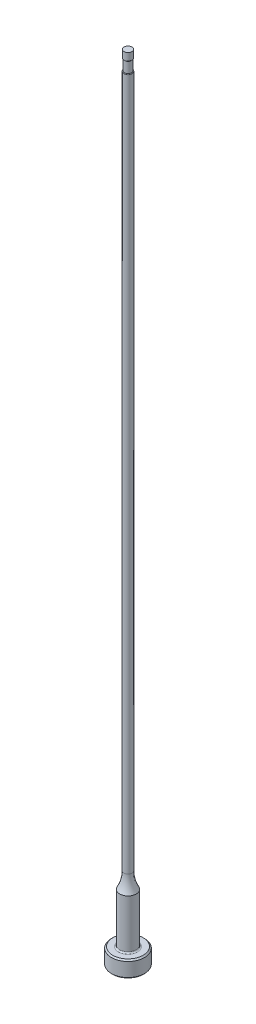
SolidWorks part; units mm, degrees
ref_plane "Front Plane" through (0, 0, 0) normal (0, 0, 1) x (1, 0, 0)
ref_plane "Top Plane" through (0, 0, 0) normal (0, 1, 0) x (1, 0, 0)
ref_plane "Right Plane" through (0, 0, 0) normal (1, 0, 0) x (0, 0, -1)
other "Configuration Table"
sketch "Sketch1" plane through (0, 0, 0) normal (0, 0, 1) x (1, 0, 0)
  line L0 (0, 259.9588) -> (0, -15.1925) construction
  line L1 (0, 0) -> (-3.175, 0)
  line L2 (-3.175, 0) -> (-3.175, 3.175)
  line L3 (-3.175, 3.175) -> (-1.5875, 3.175)
  line L4 (-0.7937, 15.7742) -> (-0.7937, 152.4)
  line L5 (-0.7937, 152.4) -> (0, 152.4)
  line L6 (0, 152.4) -> (0, 0)
  line L7 (-1.5875, 3.175) -> (-1.5875, 12.7)
  arc A1 (-1.5875, 12.7) -> (-0.7937, 15.7742) centre (-7.1437, 15.7742) ccw
  dimension "D1" = 6.35
  dimension "L" = 152.4
  dimension "D2" = 3.175
  dimension "H" = 6.35
  dimension "T" = 3.175
  dimension "D" = 1.5875
  dimension "S" = 12.7
revolve "Revolve1" add sketch "Sketch1" angle 360 about L0
chamfer "Chamfer1" distance 0.254 angle 45 2 edges at (0, 3.175, 3.175) (0, 0, 3.175)
fillet "Fillet1" radius 0.254 1 edges at (0, 3.175, 1.5875)
sketch "Sketch2" plane through (0, 0, 0) normal (0, 0, 1) x (1, 0, 0)
  line L0 (-0.7937, 152.4) -> (-0.7937, 15.7742) construction
  line L1 (-0.7937, 150.876) -> (-0.6921, 150.876)
  line L2 (-0.7937, 150.876) -> (-0.7937, 148.844)
  line L3 (-0.7937, 148.844) -> (-0.6921, 148.844)
  line L4 (-0.6921, 150.876) -> (-0.6921, 148.844)
  line L5 (0.7937, 152.4) -> (-0.7937, 152.4) construction
  line L6 (0, 153.4483) -> (0, 147.3282) construction
  dimension "D1" = 2.032
  dimension "N" = 1.524
  dimension "FD" = 0.1016
  dimension "D3" = 1.3843
revolve "Vent Relief" cut sketch "Sketch2" angle 360 about L6
sketch "Sketch3" plane through (0, 0, 0) normal (0, 0, 1) x (1, 0, 0)
  line L0 (-0.6921, 149.86) -> (-0.6921, 111.76)
  line L1 (-0.6921, 150.876) -> (-0.6921, 148.844) construction
  line L2 (-0.7937, 148.844) -> (-0.7937, 15.7742) construction
  line L3 (-0.7937, 110.9632) -> (-0.7937, 149.86)
  line L4 (-0.7937, 149.86) -> (-0.6921, 149.86)
  arc A0 (-0.6921, 111.76) -> (-0.7937, 110.9632) centre (-3.8671, 111.76) cw
  dimension "D1" = 3.175
  dimension "D2" = 38.1
extrude "D-Slot" cut sketch "Sketch3" against normal through all both and the other way through all
sketch "Sketch5" plane through (0, 0, 0) normal (0, 0, 1) x (1, 0, 0)
  line L0 (-0.7937, 150.876) -> (0.7937, 150.876) construction
  line L1 (-0.7937, 152.4) -> (-0.7683, 152.4)
  line L2 (-0.7937, 152.4) -> (-0.7937, 150.876)
  line L3 (-0.7937, 150.876) -> (-0.7683, 150.876)
  line L4 (-0.7683, 152.4) -> (-0.7683, 150.876)
  line L5 (0, 152.6877) -> (0, 150.5771) construction
  dimension "VP" = 0.0254
revolve "Vent Diameter" cut sketch "Sketch5" angle 360 about L5
fillet "Fillet2" radius 0.127 2 edges at (0.7937, 148.844, 0) (0, 150.876, 0.7683)
sketch "Pocket Sketch" plane through (0, 0, 0) normal (0, 0, 1) x (1, 0, 0)
  line L0 (-3.5719, 0) -> (-3.5719, 3.2004)
  line L1 (-3.5719, 3.2004) -> (-1.7542, 3.2004)
  line L2 (-0.9922, 3.9624) -> (-0.9922, 22.225)
  line L3 (-0.9922, 22.225) -> (0, 22.225)
  line L4 (0, 22.225) -> (0, 0)
  line L5 (0, 0) -> (-3.5719, 0)
  line L6 (0, 12.6104) -> (0, -2.4989) construction
  line L7 (-3.175, 2.921) -> (-3.175, 0.254) construction
  line L8 (2.921, 3.175) -> (-2.921, 3.175) construction
  line L9 (-0.7937, 110.9632) -> (-0.7937, 15.7742) construction
  line L10 (-1.7542, 3.2004) -> (-0.9922, 3.9624)
  point P3 (-0.9922, 3.2004)
  dimension "D1" = 7.1437
  dimension "D2" = 0.3969
  dimension "D3" = 0.0254
  dimension "D4" = 0.1984
  dimension "D5" = 1.9844
  dimension "D6" = 22.225
